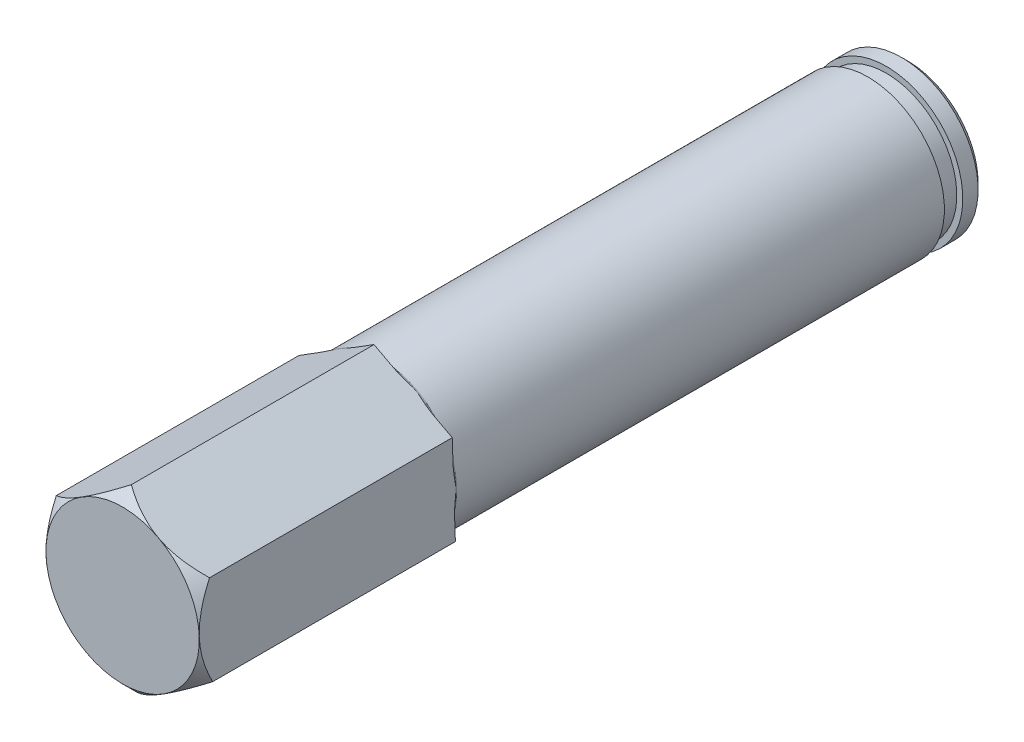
SolidWorks part; units mm, degrees
ref_plane "Front Plane" through (0, 0, 0) normal (0, 0, 1) x (1, 0, 0)
ref_plane "Top Plane" through (0, 0, 0) normal (0, 1, 0) x (1, 0, 0)
ref_plane "Right Plane" through (0, 0, 0) normal (1, 0, 0) x (0, 0, -1)
sketch "Sketch1" plane through (0, 0, 0) normal (0, 0, 1) x (1, 0, 0)
  line L1 (-0.1302, 3.6639) -> (-3.2381, 1.7192)
  line L2 (-3.2381, 1.7192) -> (-3.1079, -1.9447)
  line L3 (-3.1079, -1.9447) -> (0.1302, -3.6639)
  line L4 (0.1302, -3.6639) -> (3.2381, -1.7192)
  line L5 (3.2381, -1.7192) -> (3.1079, 1.9447)
  line L6 (3.1079, 1.9447) -> (-0.1302, 3.6639)
  circle A0 centre (0, 0) radius 3.175 construction
  dimension "D1" = 6.35
extrude "Boss-Extrude1" add sketch "Sketch1" against normal blind 32.512
sketch "Sketch4" plane through (0, 0, 0) normal (0, -1, 0) x (1, 0, 0)
  line L0 (0, 0) -> (0, 4.2733) construction
  line L1 (0, 0) -> (-3.175, 0) construction
  line L2 (-3.175, 0) -> (-4.1682, -0.9932)
  line L3 (-4.1682, -0.9932) -> (-4.1682, 0)
  line L4 (-4.1682, 0) -> (-3.175, 0)
  line L5 (0, -32.512) -> (-2.9146, -32.512) construction
  line L6 (-3.2381, -32.512) -> (-3.1079, -32.512) construction
  line L7 (-2.9146, -32.512) -> (-3.1686, -32.258)
  line L8 (-3.1686, -31.623) -> (-3.1686, -32.258)
  line L9 (-3.1686, -31.623) -> (-2.921, -31.623)
  line L10 (-2.921, -31.623) -> (-2.921, -30.861)
  line L11 (-2.921, -30.861) -> (-3.1686, -30.861)
  line L13 (-5.2278, -10.541) -> (-5.2278, -32.512)
  line L14 (-5.2278, -32.512) -> (-2.9146, -32.512)
  line L15 (0, -32.512) -> (0, 0) construction
  line L17 (-3.1686, -30.861) -> (-3.1686, -24.892)
  line L18 (-3.1686, -24.892) -> (-3.1687, -16.0985)
  line L21 (-3.1687, -16.0985) -> (-3.1686, -10.668)
  line L22 (-3.2956, -10.541) -> (-5.2278, -10.541)
  arc A0 (-3.1686, -10.668) -> (-3.2956, -10.541) centre (-3.2956, -10.668) ccw
  point P22 (-3.1686, -10.541)
  dimension "D10" = 0.127
  dimension "D2" = 45
  dimension "D3" = 7.62
  dimension "D4" = 45
  dimension "D5" = 0.762
  dimension "D6" = 5.842
  dimension "D7" = 0.254
  dimension "D8" = 6.35
  dimension "D9" = 6.3373
  dimension "D11" = 5.5575
  dimension "D12" = 10.541
  dimension "D14" = 21.082
revolve "Cut-Revolve1" cut sketch "Sketch4" angle 360 about L15
